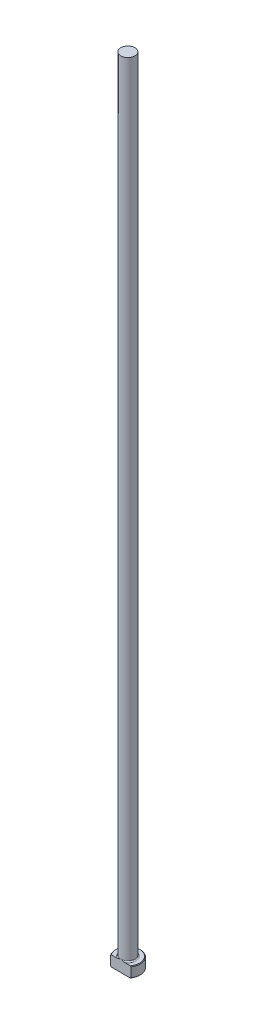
SolidWorks part; units mm, degrees
ref_plane "Front Plane" through (0, 0, 0) normal (0, 0, 1) x (1, 0, 0)
ref_plane "Top Plane" through (0, 0, 0) normal (0, 1, 0) x (1, 0, 0)
ref_plane "Right Plane" through (0, 0, 0) normal (1, 0, 0) x (0, 0, -1)
sketch "Sketch1" plane through (0, 0, 0) normal (0, 0, 1) x (1, 0, 0)
  line L0 (0, 259.9588) -> (0, -15.1925) construction
  line L1 (0, 0) -> (-5.5499, 0)
  line L2 (-5.5499, 0) -> (-5.5499, 4.7498)
  line L3 (-5.5499, 4.7498) -> (-3.175, 4.7498)
  line L4 (-3.175, 4.7498) -> (-3.175, 355.6)
  line L5 (-3.175, 355.6) -> (0, 355.6)
  line L6 (0, 355.6) -> (0, 0)
  dimension "L" = 355.6
  dimension "H" = 11.0998
  dimension "T" = 4.7498
  dimension "D" = 6.35
revolve "Revolve1" add sketch "Sketch1" angle 360 about L0
chamfer "Chamfer1" distance 0.254 angle 45 2 edges at (0, 4.7498, 5.5499) (0, 0, 5.5499)
fillet "Fillet1" radius 0.508 1 edges at (0, 4.7498, 3.175)
sketch "Sketch2" plane through (0, 0, 0) normal (0, -1, 0) x (1, 0, 0)
  line L0 (-4.552, 3.175) -> (4.552, 3.175)
  arc A0 (4.552, 3.175) -> (-4.552, 3.175) centre (0, 0) ccw
  circle A1 centre (0, 0) radius 5.5499 construction
  circle A3 centre (0, 0) radius 3.175 construction
extrude "KEY" cut sketch "Sketch2" against normal through all
sketch "Pocket Sketch" plane through (0, 0, 0) normal (0, 0, 1) x (1, 0, 0)
  line L0 (-5.9468, 0) -> (-5.9468, 4.7752)
  line L1 (-5.9468, 4.7752) -> (-4.3339, 4.7752)
  line L2 (-3.5719, 5.5372) -> (-3.5719, 22.225)
  line L3 (-3.5719, 22.225) -> (0, 22.225)
  line L4 (0, 22.225) -> (0, 0)
  line L5 (0, 0) -> (-5.9468, 0)
  line L6 (0, 12.6104) -> (0, -2.4989) construction
  line L7 (-5.5499, 4.4958) -> (-5.5499, 0.254) construction
  line L8 (5.2959, 4.7498) -> (-5.2959, 4.7498) construction
  line L9 (-3.175, 355.6) -> (-3.175, 5.2578) construction
  line L10 (-4.3339, 4.7752) -> (-3.5719, 5.5372)
  point P3 (-3.5719, 4.7752)
  dimension "D1" = 11.8935
  dimension "D2" = 0.3969
  dimension "D3" = 0.0254
  dimension "D4" = 0.3969
  dimension "D5" = 7.1437
  dimension "D6" = 22.225
